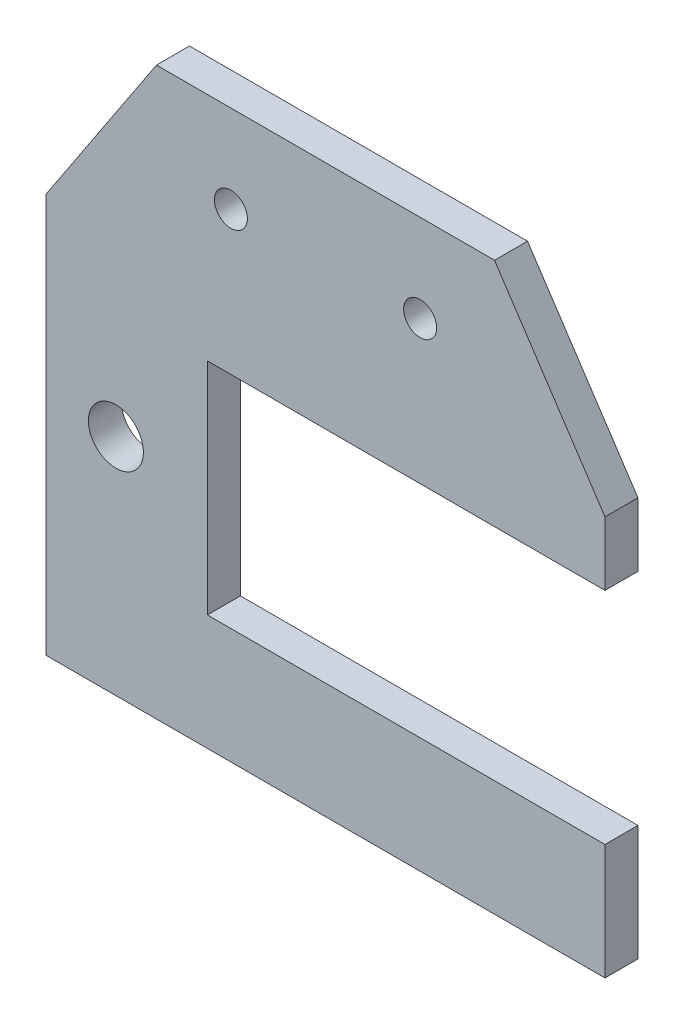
SolidWorks part; units mm, degrees
ref_plane "Front Plane" through (0, 0, 0) normal (0, 0, 1) x (1, 0, 0)
ref_plane "Top Plane" through (0, 0, 0) normal (0, 1, 0) x (1, 0, 0)
ref_plane "Right Plane" through (0, 0, 0) normal (1, 0, 0) x (0, 0, -1)
sketch "Sketch1" plane through (0, 0, 0) normal (0, 0, 1) x (1, 0, 0)
  line L0 (0, -12.3213) -> (0, 39.1607)
  line L1 (15.365, 39.1607) -> (-15.365, 39.1607)
  line L2 (-15.365, 39.1607) -> (-25.4023, 23.9787)
  line L3 (-25.4023, 23.9787) -> (-25.4023, -12.3213)
  line L4 (-25.4023, -12.3213) -> (25.4023, -12.3213)
  line L5 (25.4023, 23.9787) -> (25.4023, -12.3213)
  line L6 (15.365, 39.1607) -> (25.4023, 23.9787)
  line L8 (-10.7377, 18.1887) -> (25.4023, 18.1887)
  line L9 (-10.7377, 18.1887) -> (-10.7377, -1.8113)
  line L10 (-10.7377, -1.8113) -> (25.4023, -1.8113)
  line L11 (25.4023, 18.1887) -> (25.4023, -1.8113)
  line L12 (-10.7377, 18.1887) -> (25.4023, -1.8113) construction
  line L13 (-10.7377, -1.8113) -> (25.4023, 18.1887) construction
  circle A0 centre (-19.0523, 8.0787) radius 2.5
  circle A1 centre (-8.6023, 31.1907) radius 1.5
  circle A2 centre (8.6023, 31.1907) radius 1.5
  point P9 (7.3323, 8.1887)
  dimension "D8" = 3
  dimension "D9" = 3
  dimension "D10" = 5
  dimension "D11" = 6.35
  dimension "D12" = 20.4
  dimension "D13" = 7.97
  dimension "D14" = 3
  dimension "D15" = 7.97
  dimension "D16" = 16.8
  dimension "D17" = 16.8
  dimension "D1" = 213.47
  dimension "D2" = 36.3
  dimension "D3" = 18.2
  dimension "D4" = 30.73
  dimension "D5" = 10.51
  dimension "D6" = 20
  dimension "D7" = 36.14
extrude "Boss-Extrude1" add sketch "Sketch1" along normal blind 3 contours L10 L9 L8 L0 L1 L2 L3 L4 A1 A0 | L0 L8 L5 L6 L1 A2 | L10 L0 L4 L5
